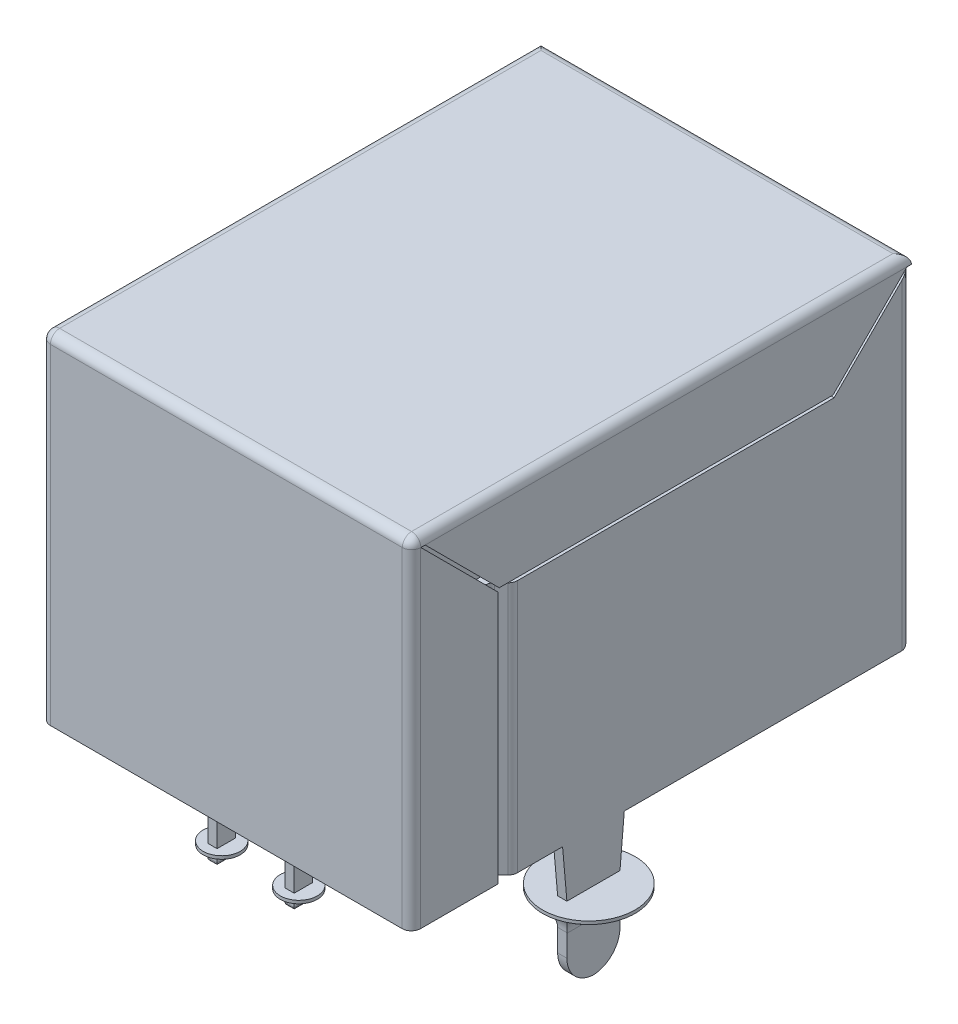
SolidWorks part; units mm, degrees
ref_plane "Plan de face" through (0, 0, 0) normal (0, 0, 1) x (1, 0, 0)
ref_plane "Plan de dessus" through (0, 0, 0) normal (0, 1, 0) x (1, 0, 0)
ref_plane "Plan de droite" through (0, 0, 0) normal (1, 0, 0) x (0, 0, -1)
sketch "Esquisse1" plane through (0, 0, 0) normal (0, 1, 0) x (1, 0, 0)
  line L0 (-0.0121, 2.9364) -> (0.2121, 2.7121)
  line L1 (0.3, 2.5) -> (0.3, 0)
  line L2 (-0.4, 3.0243) -> (-0.4, 15.7879)
  line L3 (-0.4, 15.7879) -> (11.6, 15.7879)
  line L4 (11.6, 15.7879) -> (11.6, 3.0243)
  line L5 (0.3, 0) -> (0, 0)
  line L6 (0, 0) -> (0, 2.3757)
  line L7 (-0.0879, 2.5879) -> (-0.3121, 2.8121)
  line L8 (11.2121, 2.9364) -> (10.9879, 2.7121)
  line L9 (10.9, 2.5) -> (10.9, 0)
  line L10 (11.3, 3.1485) -> (11.3, 15.4879)
  line L11 (11.3, 15.4879) -> (-0.1, 15.4879)
  line L12 (-0.1, 15.4879) -> (-0.1, 3.1485)
  line L13 (10.9, 0) -> (11.2, 0)
  line L14 (11.2, 0) -> (11.2, 2.3757)
  line L15 (11.2879, 2.5879) -> (11.5121, 2.8121)
  arc A0 (11.2, 2.3757) -> (11.2879, 2.5879) centre (11.5, 2.3757) cw
  arc A1 (11.6, 3.0243) -> (11.5121, 2.8121) centre (11.3, 3.0243) cw
  arc A2 (10.9, 2.5) -> (10.9879, 2.7121) centre (11.2, 2.5) cw
  arc A3 (11.2121, 2.9364) -> (11.3, 3.1485) centre (11, 3.1485) ccw
  arc A4 (0, 2.3757) -> (-0.0879, 2.5879) centre (-0.3, 2.3757) ccw
  arc A5 (-0.4, 3.0243) -> (-0.3121, 2.8121) centre (-0.1, 3.0243) ccw
  arc A6 (0.3, 2.5) -> (0.2121, 2.7121) centre (0, 2.5) ccw
  arc A7 (-0.1, 3.1485) -> (-0.0121, 2.9364) centre (0.2, 3.1485) ccw
  point P19 (11.2, 2.5)
  point P26 (11.3, 3.0243)
  point P29 (0, 2.5)
  point P36 (-0.1, 3.0243)
  dimension "D14" = 0.3
  dimension "D1" = 12
  dimension "D2" = 0.3
  dimension "D3" = 0.3
  dimension "D4" = 0.3
  dimension "D5" = 0.3
  dimension "D6" = 0.3
  dimension "D7" = 0.3
  dimension "D8" = 0.3
  dimension "D9" = 13.2
  dimension "D10" = 2.5
  dimension "D11" = 2.5
  dimension "D12" = 135
  dimension "D13" = 135
  dimension "D15" = 0.1
  dimension "D16" = 0.1
extrude "Boss.-Extru.1" add sketch "Esquisse1" along normal blind 8.2
sketch "Esquisse2" plane through (11.6, 0, 0) normal (1, 0, 0) x (0, 0, -1)
  line L0 (15.7879, 8.2) -> (15.7879, 10.7)
  line L1 (15.7879, 10.7) -> (13.2879, 8.2)
  line L2 (3.0243, 8.2) -> (15.7879, 8.2) construction
  line L3 (13.2879, 8.2) -> (15.7879, 8.2)
  dimension "D1" = 2.5
  dimension "D2" = 45
extrude "Boss.-Extru.2" add sketch "Esquisse2" against normal blind 0.3
sketch "Esquisse3" plane through (-0.4, 0, 0) normal (-1, 0, 0) x (0, 0, 1)
  line L0 (-15.7879, 8.2) -> (-15.7879, 10.7)
  line L1 (-15.7879, 10.7) -> (-13.2879, 8.2)
  line L2 (-13.2879, 8.2) -> (-15.7879, 8.2)
extrude "Boss.-Extru.3" add sketch "Esquisse3" against normal blind 0.3
fillet "Congé1" radius 0.3 2 edges at (-0.4, 5.35, -15.7879) (11.6, 5.35, -15.7879)
sketch "Esquisse4" plane through (0, 0, 0) normal (0, -1, 0) x (1, 0, 0)
  line L0 (-0.1, -2.3879) -> (-0.4, -2.3879)
  line L2 (-0.4, -2.3879) -> (-0.4, 0.4121)
  line L3 (-0.4, 0.4121) -> (11.6, 0.4121)
  line L4 (11.6, 0.4121) -> (11.6, -2.3879)
  line L5 (11.6, -2.3879) -> (11.3, -2.3879)
  line L7 (11.3, -2.3879) -> (11.3, 0.1121)
  line L8 (11.3, 0.1121) -> (-0.1, 0.1121)
  line L9 (-0.1, 0.1121) -> (-0.1, -2.3879)
  line L10 (11.3, -15.7879) -> (-0.1, -15.7879) construction
  line L11 (0, -2.3757) -> (0, 0) construction
  line L12 (11.2, 0) -> (11.2, -2.3757) construction
  dimension "D1" = 0.3
  dimension "D2" = 0.3
  dimension "D3" = 0.3
  dimension "D4" = 16.2
  dimension "D5" = 2.8
  dimension "D6" = 2.8
  dimension "D7" = 0.1
  dimension "D8" = 0.1
extrude "Boss.-Extru.6" add sketch "Esquisse4" against normal blind 11
sketch "Esquisse7" plane through (11.6, 0, 0) normal (1, 0, 0) x (0, 0, -1)
  line L0 (2.3879, 8.2) -> (-0.4121, 11)
  line L2 (2.3879, 11) -> (2.3879, 0) construction
  line L4 (2.5879, 8.2) -> (2.3757, 8.2) construction
  line L5 (-0.4121, 11) -> (-0.4121, 0) construction
  line L6 (-0.4121, 11) -> (2.3879, 11)
  line L7 (2.3879, 11) -> (2.3879, 8.2)
  dimension "D1" = 45
extrude "Enlèv. mat.-Extru.5" cut sketch "Esquisse7" against normal through all
fillet "Congé2" radius 0.3 2 edges at (11.6, 5.5, 0.4121) (-0.4, 5.5, 0.4121)
sketch "Esquisse8" plane through (0, 0, 0.4121) normal (0, 0, 1) x (1, 0, 0)
  line L0 (-0.4, 0) -> (-0.4, 10.7) construction
  line L1 (-0.4, 10.7) -> (11.6057, 10.7)
  line L2 (-0.4, 10.7) -> (-0.4, 11)
  line L3 (-0.4, 11) -> (11.6057, 11)
  line L4 (11.6057, 10.7) -> (11.6057, 11)
  line L5 (11.3, 11) -> (-0.1, 11) construction
  dimension "D1" = 0.3
extrude "Boss.-Extru.8" add sketch "Esquisse8" against normal up to surface (16.2 mm away)
fillet "Congé3" radius 0.3 1 edges at (5.6029, 11, 0.4121)
sketch "Esquisse11" plane through (11.6057, 0, 0) normal (1, 0, 0) x (0, 0, -1)
  line L0 (0.0293, 10.7) -> (2.4293, 8.3)
  line L1 (15.7879, 10.7) -> (-0.4121, 10.7) construction
  line L2 (2.4293, 8.3) -> (13.2464, 8.3)
  line L3 (13.2464, 8.3) -> (15.6464, 10.7)
  line L4 (15.6464, 10.7) -> (0.0293, 10.7)
  line L5 (-0.1121, 10.7) -> (2.3879, 8.2) construction
  line L6 (15.4879, 10.4) -> (13.2879, 8.2) construction
  line L7 (3.0243, 8.2) -> (13.2879, 8.2) construction
  dimension "D1" = 0.1
  dimension "D2" = 0.1
  dimension "D3" = 0.1
extrude "Boss.-Extru.10" add sketch "Esquisse11" against normal blind 0.3
sketch "Esquisse12" plane through (-0.4, 0, 0) normal (-1, 0, 0) x (0, 0, 1)
  line L0 (-15.6464, 10.7) -> (-13.2464, 8.3)
  line L1 (-13.2464, 8.3) -> (-2.4293, 8.3)
  line L2 (-2.4293, 8.3) -> (-0.0293, 10.7)
  line L3 (-0.0293, 10.7) -> (-15.6464, 10.7)
extrude "Boss.-Extru.11" add sketch "Esquisse12" against normal blind 0.3
sketch "Esquisse13" plane through (0, 8.2, 0) normal (0, 1, 0) x (1, 0, 0)
  line L1 (-0.1, 15.4879) -> (11.3, 15.4879)
  line L2 (-0.1, 15.4879) -> (-0.1, 15.7879)
  line L3 (-0.1, 15.7879) -> (11.3, 15.7879)
  line L4 (11.3, 15.4879) -> (11.3, 15.7879)
extrude "Boss.-Extru.12" add sketch "Esquisse13" along normal up to next
fillet "Congé4" radius 0.3 5 edges at (-0.4, 10.9121, 0.3243) (11.6057, 10.9121, 0.3243) (5.6029, 11, -15.7879) (-0.4, 11, -7.8379) (11.6057, 11, -7.8379)
sketch "Esquisse14" plane through (0, 0, -15.7879) normal (0, 0, -1) x (-1, 0, 0)
  line L0 (-1.1, 1.5) -> (-10.1, 1.5)
  line L1 (-10.4, 1.8) -> (-10.4, 3.3)
  line L2 (-10.4, 3.7) -> (-10.4, 6.9)
  line L3 (-10.4, 7.3) -> (-10.4, 8.1757)
  line L4 (-10.3121, 8.3879) -> (-8.6879, 10.0121)
  line L5 (-8.4757, 10.1) -> (-2.7243, 10.1)
  line L6 (-2.5121, 10.0121) -> (-0.8879, 8.3879)
  line L7 (-0.8, 8.1757) -> (-0.8, 7.3)
  line L8 (-0.8, 6.9) -> (-0.8, 3.7)
  line L9 (-0.8, 3.3) -> (-0.8, 1.8)
  line L10 (-11.3057, 11) -> (0.1, 11) construction
  line L11 (-11.6, 0) -> (-11.6, 10.4) construction
  line L12 (0.4, 10.4) -> (0.4, 0) construction
  arc A0 (-10.4, 7.3) -> (-10.4, 6.9) centre (-10.4, 7.1) ccw
  arc A1 (-10.4, 3.7) -> (-10.4, 3.3) centre (-10.4, 3.5) ccw
  arc A2 (-0.8, 7.3) -> (-0.8, 6.9) centre (-0.8, 7.1) cw
  arc A3 (-0.8, 3.7) -> (-0.8, 3.3) centre (-0.8, 3.5) cw
  arc A4 (-2.7243, 10.1) -> (-2.5121, 10.0121) centre (-2.7243, 9.8) cw
  arc A5 (-0.8879, 8.3879) -> (-0.8, 8.1757) centre (-1.1, 8.1757) cw
  arc A6 (-0.8, 1.8) -> (-1.1, 1.5) centre (-1.1, 1.8) cw
  arc A7 (-10.1, 1.5) -> (-10.4, 1.8) centre (-10.1, 1.8) cw
  arc A8 (-10.4, 8.1757) -> (-10.3121, 8.3879) centre (-10.1, 8.1757) cw
  arc A9 (-8.6879, 10.0121) -> (-8.4757, 10.1) centre (-8.4757, 9.8) cw
  point P28 (-0.8, 8.3)
  point P35 (-10.4, 8.3)
  dimension "D7" = 0.2
  dimension "D10" = 0.3
  dimension "D1" = 1.2
  dimension "D2" = 8.6
  dimension "D3" = 0.9
  dimension "D4" = 135
  dimension "D5" = 1.2
  dimension "D6" = 1.8
  dimension "D8" = 2
  dimension "D9" = 3.6
extrude "Enlèv. mat.-Extru.6" cut sketch "Esquisse14" against normal up to next
sketch "Esquisse15" plane through (10.4, 0, 0) normal (-1, 0, 0) x (0, 0, 1)
  line L1 (-15.7879, 6.9) -> (-15.4879, 6.9)
  line L2 (-15.7879, 6.9) -> (-15.7879, 3.7)
  line L3 (-15.7879, 3.7) -> (-15.4879, 3.7)
  line L4 (-15.4879, 6.9) -> (-15.4879, 3.7)
extrude "Boss.-Extru.13" add sketch "Esquisse15" along normal blind 0.3
sketch "Esquisse16" plane through (0.8, 0, 0) normal (1, 0, 0) x (0, 0, -1)
  line L1 (15.4879, 6.9) -> (15.7879, 6.9)
  line L2 (15.4879, 6.9) -> (15.4879, 3.7)
  line L3 (15.4879, 3.7) -> (15.7879, 3.7)
  line L4 (15.7879, 6.9) -> (15.7879, 3.7)
extrude "Boss.-Extru.14" add sketch "Esquisse16" along normal blind 0.3
sketch "Esquisse17" plane through (0, 6.9, 0) normal (0, 1, 0) x (1, 0, 0)
  line L0 (0.8, 15.7879) -> (1.1, 15.7879)
  line L3 (1.1, 15.7879) -> (1.3963, 12.4008)
  line L4 (1.3963, 12.4008) -> (1.0963, 12.4008)
  line L5 (1.0963, 12.4008) -> (0.8, 15.7879)
  line L6 (11.3057, 15.4879) -> (-0.1, 15.4879) construction
  line L7 (10.1, 15.7879) -> (10.4, 15.7879)
  line L8 (10.4, 15.7879) -> (10.1037, 12.4008)
  line L9 (10.1037, 12.4008) -> (9.8037, 12.4008)
  line L10 (9.8037, 12.4008) -> (10.1, 15.7879)
  dimension "D1" = 3.4
  dimension "D2" = 95
  dimension "D3" = 95
extrude "Boss.-Extru.15" add sketch "Esquisse17" against normal blind 3.2
fillet "Congé5" radius 0.3 2 edges at (1.1, 5.3, -15.7879) (10.1, 5.3, -15.7879)
sketch "Esquisse18" plane through (0, 0, -15.4879) normal (0, 0, 1) x (1, 0, 0)
  line L0 (11.6, 10.7) -> (11.6, 0) construction
  line L1 (-0.4, 0) -> (11.6, 0)
  line L2 (-0.4, 0) -> (-0.4, 0.3)
  line L3 (-0.4, 0.3) -> (11.6, 0.3)
  line L4 (11.6, 0) -> (11.6, 0.3)
  dimension "D1" = 0.3
extrude "Boss.-Extru.16" add sketch "Esquisse18" along normal blind 2.1
fillet "Congé6" radius 0.3 1 edges at (5.6, 0, -15.7879)
sketch "Esquisse19" plane through (11.3, 0, 0) normal (-1, 0, 0) x (0, 0, 1)
  line L0 (-15.4879, 0) -> (-3.0243, 0) construction
  line L1 (-13.2879, 0) -> (-6.8879, 0)
  line L2 (-13.2879, 0) -> (-13.2879, 0.3)
  line L3 (-13.2879, 0.3) -> (-6.8879, 0.3)
  line L4 (-6.8879, 0) -> (-6.8879, 0.3)
  line L5 (-15.4879, 0.3) -> (-13.3879, 0.3) construction
  line L6 (-13.3879, 0.3) -> (-13.3879, 0) construction
  dimension "D1" = 6.4
  dimension "D2" = 0.1
extrude "Boss.-Extru.17" add sketch "Esquisse19" along normal blind 1.1
sketch "Esquisse20" plane through (-0.1, 0, 0) normal (1, 0, 0) x (0, 0, -1)
  line L1 (6.8879, 0.3) -> (13.2879, 0.3)
  line L2 (6.8879, 0.3) -> (6.8879, 0)
  line L3 (6.8879, 0) -> (13.2879, 0)
  line L4 (13.2879, 0.3) -> (13.2879, 0)
extrude "Boss.-Extru.18" add sketch "Esquisse20" along normal blind 1.1
sketch "Esquisse21" plane through (-0.4, 0, 0) normal (-1, 0, 0) x (0, 0, 1)
  line L0 (-4.4879, 0) -> (-4.6278, -1.6)
  line L1 (-15.4879, 0) -> (-3.0243, 0) construction
  line L2 (-4.6278, -1.6) -> (-6.3479, -1.6)
  line L3 (-6.3479, -1.6) -> (-6.4879, 0)
  line L4 (-6.4879, 0) -> (-4.4879, 0)
  line L5 (-15.7879, 10.7) -> (-15.7879, 0.3) construction
  dimension "D1" = 85
  dimension "D2" = 85
  dimension "D3" = 2
  dimension "D4" = 1.6
  dimension "D5" = 9.3
extrude "Boss.-Extru.19" add sketch "Esquisse21" against normal blind 0.3
sketch "Esquisse22" plane through (11.6, 0, 0) normal (1, 0, 0) x (0, 0, -1)
  line L0 (4.4879, 0) -> (4.6278, -1.6)
  line L1 (4.6278, -1.6) -> (6.3479, -1.6)
  line L2 (6.3479, -1.6) -> (6.4879, 0)
  line L3 (6.4879, 0) -> (4.4879, 0)
extrude "Boss.-Extru.20" add sketch "Esquisse22" against normal blind 0.3
sketch "Esquisse23" plane through (0, 0, -15.4879) normal (0, 0, 1) x (1, 0, 0)
  line L0 (11.3, 10.7) -> (11.3, 0.3)
  line L1 (11.3, 0.3) -> (-0.1, 0.3)
  line L2 (-0.1, 0.3) -> (-0.1, 10.7)
  line L3 (-0.1, 10.7) -> (11.3, 10.7)
  line L4 (8.4393, 9.4121) -> (9.7121, 8.1393)
  line L5 (9.8, 7.9272) -> (9.8, 7.3)
  line L6 (9.8, 7.3) -> (10.4, 7.3)
  line L7 (10.4, 7.3) -> (10.4, 3.3)
  line L8 (10.4, 3.3) -> (9.8, 3.3)
  line L9 (9.8, 3.3) -> (9.8, 2.4)
  line L10 (9.5, 2.1) -> (1.7, 2.1)
  line L11 (1.4, 2.4) -> (1.4, 3.3)
  line L12 (1.4, 3.3) -> (0.8, 3.3)
  line L13 (0.8, 3.3) -> (0.8, 7.3)
  line L14 (0.8, 7.3) -> (1.4, 7.3)
  line L15 (1.4, 7.3) -> (1.4, 7.9272)
  line L16 (1.4879, 8.1393) -> (2.7607, 9.4121)
  line L17 (2.9728, 9.5) -> (8.2272, 9.5)
  line L18 (2.7243, 10.1) -> (8.4757, 10.1) construction
  line L19 (10.1, 1.5) -> (1.1, 1.5) construction
  line L20 (10.4, 8.1757) -> (10.4, 7.3) construction
  line L21 (0.8, 7.3) -> (0.8, 8.1757) construction
  line L22 (8.6879, 10.0121) -> (10.3121, 8.3879) construction
  line L23 (0.8879, 8.3879) -> (2.5121, 10.0121) construction
  arc A0 (1.4, 2.4) -> (1.7, 2.1) centre (1.7, 2.4) ccw
  arc A1 (9.5, 2.1) -> (9.8, 2.4) centre (9.5, 2.4) ccw
  arc A2 (1.4, 7.9272) -> (1.4879, 8.1393) centre (1.7, 7.9272) cw
  arc A3 (2.7607, 9.4121) -> (2.9728, 9.5) centre (2.9728, 9.2) cw
  arc A4 (8.2272, 9.5) -> (8.4393, 9.4121) centre (8.2272, 9.2) cw
  arc A5 (9.7121, 8.1393) -> (9.8, 7.9272) centre (9.5, 7.9272) cw
  dimension "D7" = 0.3
  dimension "D1" = 0.6
  dimension "D2" = 0.6
  dimension "D3" = 0.6
  dimension "D4" = 0.6
  dimension "D5" = 0.6
  dimension "D6" = 0.6
extrude "Boss.-Extru.21" add sketch "Esquisse23" along normal blind 8.4
chamfer "Chanfrein1" distance 0.3 angle 45 19 edges at (9.8, 2.85, -7.0879) (9.7121, 2.1879, -7.0879) (1.4, 2.85, -7.0879) (5.6, 2.1, -7.0879) (1.4879, 2.1879, -7.0879) (1.4, 2.85, -15.4879) (1.4879, 2.1879, -15.4879) (9.8, 2.85, -15.4879) (9.7121, 2.1879, -15.4879) (5.6, 2.1, -15.4879) (1.4, 7.6136, -15.4879) (1.4228, 8.042, -15.4879) (2.1243, 8.7757, -15.4879) (2.858, 9.4772, -15.4879) (5.6, 9.5, -15.4879) (8.342, 9.4772, -15.4879) (9.0757, 8.7757, -15.4879) (9.7772, 8.042, -15.4879) (9.8, 7.6136, -15.4879)
sketch "Esquisse24" plane through (0, 10.7, 0) normal (0, -1, 0) x (1, 0, 0)
  line L0 (-0.1, -7.0879) -> (-0.1, -3.1485)
  line L1 (-0.1, -3.1485) -> (0.3, -3.1485)
  line L2 (0.3, -3.1485) -> (0.3, 0.1121)
  line L3 (-0.1, 0.1121) -> (11.3, 0.1121) construction
  line L4 (0.3, 0.1121) -> (10.9, 0.1121)
  line L5 (10.9, 0.1121) -> (10.9, -3.1485)
  line L6 (10.9, -3.1485) -> (11.3, -3.1485)
  line L7 (11.3, -3.1485) -> (11.3, -7.0879)
  line L8 (11.3, -7.0879) -> (-0.1, -7.0879)
extrude "Boss.-Extru.22" add sketch "Esquisse24" along normal up to surface (10.4 mm away)
sketch "Esquisse25" plane through (0, 0, -7.0879) normal (0, 0, -1) x (-1, 0, 0)
  line L0 (-9.5, 2.1) -> (-1.7, 2.1) construction
  line L1 (-8.4, 7.6) -> (-2.8, 7.6)
  line L2 (-8.4, 7.6) -> (-8.4, 4.4)
  line L3 (-8.4, 4.4) -> (-2.8, 4.4)
  line L4 (-2.8, 7.6) -> (-2.8, 4.4)
  point P6 (-5.6, 2.1)
  point P7 (-5.6, 4.4)
  dimension "D1" = 5.6
  dimension "D2" = 3.2
  dimension "D3" = 2.3
extrude "Boss.-Extru.23" add sketch "Esquisse25" along normal blind 8
chamfer "Chanfrein2" distance 0.3 angle 45 4 edges at (2.8, 6, -15.0879) (5.6, 4.4, -15.0879) (8.4, 6, -15.0879) (5.6, 7.6, -15.0879)
sketch "Esquisse26" plane through (0, 0.3, 0) normal (0, -1, 0) x (1, 0, 0)
  line L1 (4.1556, -3.0336) -> (4.4556, -3.0336)
  line L2 (4.1556, -3.0336) -> (4.1556, -2.4336)
  line L3 (4.1556, -2.4336) -> (4.4556, -2.4336)
  line L4 (4.4556, -3.0336) -> (4.4556, -2.4336)
  line L5 (4.1556, -1.0336) -> (4.4556, -1.0336)
  line L6 (4.1556, -1.0336) -> (4.1556, -0.4336)
  line L7 (4.1556, -0.4336) -> (4.4556, -0.4336)
  line L8 (4.4556, -1.0336) -> (4.4556, -0.4336)
  line L9 (6.6556, -3.0336) -> (6.9556, -3.0336)
  line L10 (6.6556, -3.0336) -> (6.6556, -2.4336)
  line L11 (6.6556, -2.4336) -> (6.9556, -2.4336)
  line L12 (6.9556, -3.0336) -> (6.9556, -2.4336)
  line L13 (6.6556, -1.0336) -> (6.9556, -1.0336)
  line L14 (6.6556, -1.0336) -> (6.6556, -0.4336)
  line L15 (6.6556, -0.4336) -> (6.9556, -0.4336)
  line L16 (6.9556, -1.0336) -> (6.9556, -0.4336)
  dimension "D3" = 1.4
  dimension "D1" = 0.6
  dimension "D2" = 0.3
  dimension "D4" = 2.2
extrude "Boss.-Extru.24" add sketch "Esquisse26" along normal blind 1.9
sketch "Esquisse27" plane through (0, 7.6, 0) normal (0, 1, 0) x (1, 0, 0)
  line L0 (8.2272, 7.0879) -> (2.9728, 7.0879) construction
  line L1 (3.8, 14.1879) -> (5, 14.1879)
  line L2 (3.8, 14.1879) -> (3.8, 7.0879)
  line L3 (3.8, 7.0879) -> (5, 7.0879)
  line L4 (5, 14.1879) -> (5, 7.0879)
  line L5 (2.8, 14.7879) -> (2.8, 7.0879) construction
  line L6 (6.2, 14.1879) -> (7.4, 14.1879)
  line L7 (6.2, 14.1879) -> (6.2, 7.0879)
  line L8 (6.2, 7.0879) -> (7.4, 7.0879)
  line L9 (7.4, 14.1879) -> (7.4, 7.0879)
  line L10 (8.4, 14.7879) -> (8.4, 7.0879) construction
  line L11 (8.4, 14.7879) -> (2.8, 14.7879) construction
  dimension "D1" = 1.2
  dimension "D2" = 1.2
  dimension "D3" = 1
  dimension "D4" = 1
  dimension "D5" = 0.6
extrude "Enlèv. mat.-Extru.7" cut sketch "Esquisse27" against normal blind 0.75
sketch "Esquisse28" plane through (0, 4.4, 0) normal (0, -1, 0) x (1, 0, 0)
  line L1 (3.8, -7.0879) -> (5, -7.0879)
  line L2 (3.8, -7.0879) -> (3.8, -14.1879)
  line L3 (3.8, -14.1879) -> (5, -14.1879)
  line L4 (5, -7.0879) -> (5, -14.1879)
  line L5 (6.2, -7.0879) -> (7.4, -7.0879)
  line L6 (6.2, -7.0879) -> (6.2, -14.1879)
  line L7 (6.2, -14.1879) -> (7.4, -14.1879)
  line L8 (7.4, -7.0879) -> (7.4, -14.1879)
extrude "Enlèv. mat.-Extru.8" cut sketch "Esquisse28" against normal blind 0.75
sketch "Esquisse29" plane through (7.4, 0, 0) normal (-1, 0, 0) x (0, 0, 1)
  line L0 (-14.1879, 6.85) -> (-14.1879, 7.15)
  line L1 (-14.1879, 6.85) -> (-14.1879, 7.6) construction
  line L2 (-14.1879, 7.15) -> (-13.9634, 7.15)
  line L3 (-14.1879, 6.85) -> (-13.8306, 6.85)
  line L4 (-14.1879, 6.85) -> (-7.0879, 6.85) construction
  line L5 (-10.0451, 6.85) -> (-7.0879, 6.85)
  line L6 (-7.0879, 6.85) -> (-7.0879, 7.15)
  line L7 (-7.0879, 7.3) -> (-7.0879, 3.3) construction
  line L8 (-7.0879, 7.15) -> (-9.9124, 7.15)
  line L9 (-7.0879, 5.15) -> (-10.0451, 5.15)
  line L10 (-7.0879, 5.15) -> (-14.1879, 5.15) construction
  line L11 (-7.0879, 5.15) -> (-7.0879, 4.85)
  line L12 (-7.0879, 4.85) -> (-9.9124, 4.85)
  line L13 (-13.8306, 5.15) -> (-14.1879, 5.15)
  line L15 (-14.1879, 5.15) -> (-14.1879, 4.85)
  line L17 (-14.1879, 5.15) -> (-14.1879, 4.4) construction
  line L18 (-14.1879, 4.85) -> (-13.9634, 4.85)
  arc A0 (-13.6035, 6.954) -> (-10.2722, 6.954) centre (-11.9379, 5.5168) cw
  arc A1 (-13.7463, 7.2429) -> (-10.1294, 7.2429) centre (-11.9379, 5.5168) cw
  arc A2 (-13.6035, 5.046) -> (-10.2722, 5.046) centre (-11.9379, 6.4832) ccw
  arc A3 (-13.7463, 4.7571) -> (-10.1294, 4.7571) centre (-11.9379, 6.4832) ccw
  arc A4 (-13.7463, 4.7571) -> (-13.9634, 4.85) centre (-13.9634, 4.55) ccw
  arc A5 (-13.6035, 5.046) -> (-13.8306, 5.15) centre (-13.8306, 4.85) ccw
  arc A6 (-10.1294, 4.7571) -> (-9.9124, 4.85) centre (-9.9124, 4.55) cw
  arc A7 (-10.2722, 5.046) -> (-10.0451, 5.15) centre (-10.0451, 4.85) cw
  arc A8 (-10.2722, 6.954) -> (-10.0451, 6.85) centre (-10.0451, 7.15) ccw
  arc A9 (-9.9124, 7.15) -> (-10.1294, 7.2429) centre (-9.9124, 7.45) cw
  arc A10 (-13.6035, 6.954) -> (-13.8306, 6.85) centre (-13.8306, 7.15) cw
  arc A11 (-13.7463, 7.2429) -> (-13.9634, 7.15) centre (-13.9634, 7.45) cw
  point P35 (-13.8306, 4.85)
  point P38 (-13.6879, 5.15)
  point P41 (-10.0451, 4.85)
  point P44 (-10.1879, 5.15)
  point P47 (-10.1879, 6.85)
  point P50 (-10.0451, 7.15)
  point P53 (-13.6879, 6.85)
  point P56 (-13.8306, 7.15)
  dimension "D4" = 0.3
  dimension "D5" = 2.2
  dimension "D7" = 2.2
  dimension "D8" = 0.3
  dimension "D1" = 0.3
  dimension "D2" = 0.5
  dimension "D3" = 3.5
  dimension "D6" = 0.3
extrude "Boss.-Extru.32" add sketch "Esquisse29" along normal blind 1.2
pattern_linear "Répétition linéaire1" count 2 spacing 2.4 along (-1, 0, 0) of "Boss.-Extru.32"
sketch "Esquisse30" plane through (0, -1.6, 0) normal (0, -1, 0) x (1, 0, 0)
  line L0 (-0.4, -6.3479) -> (-0.4, -4.6278) construction
  line L1 (-0.1, -4.6278) -> (-0.4, -4.6278) construction
  line L2 (11.3, -4.6278) -> (11.6, -4.6278) construction
  line L3 (4.4556, -0.4336) -> (4.1556, -0.4336) construction
  line L4 (4.1556, -0.4336) -> (4.1556, -1.0336) construction
  line L5 (4.1556, -2.4336) -> (4.1556, -3.0336) construction
  line L6 (6.9556, -0.4336) -> (6.6556, -0.4336) construction
  circle A0 centre (-0.25, -5.4879) radius 1.5
  circle A1 centre (11.45, -5.4879) radius 1.5
  circle A2 centre (4.3056, -0.7336) radius 0.6
  circle A3 centre (6.8056, -0.7336) radius 0.6
  circle A4 centre (4.3056, -2.7336) radius 0.6
  circle A5 centre (6.8056, -2.7336) radius 0.6
  point P4 (-0.4, -5.4879)
  point P9 (-0.25, -4.6278)
  point P12 (11.45, -4.6278)
  point P23 (4.3056, -0.4336)
  point P26 (4.1556, -0.7336)
  point P29 (4.1556, -2.7336)
  point P32 (6.8056, -0.4336)
  dimension "D1" = 3
  dimension "D2" = 1.2
extrude "Boss.-Extru.33" add sketch "Esquisse30" along normal blind 0.1
sketch "Esquisse31" plane through (0, -1.7, 0) normal (0, -1, 0) x (1, 0, 0)
  line L1 (-0.4, -4.6278) -> (-0.1, -4.6278)
  line L2 (-0.4, -4.6278) -> (-0.4, -6.3479)
  line L3 (-0.4, -6.3479) -> (-0.1, -6.3479)
  line L4 (-0.1, -4.6278) -> (-0.1, -6.3479)
  line L5 (11.3, -4.6278) -> (11.6, -4.6278)
  line L6 (11.3, -4.6278) -> (11.3, -6.3479)
  line L7 (11.3, -6.3479) -> (11.6, -6.3479)
  line L8 (11.6, -4.6278) -> (11.6, -6.3479)
extrude "Boss.-Extru.34" add sketch "Esquisse31" along normal blind 2.4
sketch "Esquisse32" plane through (0, -1.7, 0) normal (0, -1, 0) x (1, 0, 0)
  line L1 (4.1556, -0.4336) -> (4.4556, -0.4336)
  line L2 (4.1556, -0.4336) -> (4.1556, -1.0336)
  line L3 (4.1556, -1.0336) -> (4.4556, -1.0336)
  line L4 (4.4556, -0.4336) -> (4.4556, -1.0336)
  line L5 (6.6556, -0.4336) -> (6.9556, -0.4336)
  line L6 (6.6556, -0.4336) -> (6.6556, -1.0336)
  line L7 (6.6556, -1.0336) -> (6.9556, -1.0336)
  line L8 (6.9556, -0.4336) -> (6.9556, -1.0336)
  line L9 (4.1556, -2.4336) -> (4.4556, -2.4336)
  line L10 (4.1556, -2.4336) -> (4.1556, -3.0336)
  line L11 (4.1556, -3.0336) -> (4.4556, -3.0336)
  line L12 (4.4556, -2.4336) -> (4.4556, -3.0336)
  line L13 (6.6556, -2.4336) -> (6.9556, -2.4336)
  line L14 (6.6556, -2.4336) -> (6.6556, -3.0336)
  line L15 (6.6556, -3.0336) -> (6.9556, -3.0336)
  line L16 (6.9556, -2.4336) -> (6.9556, -3.0336)
extrude "Boss.-Extru.35" add sketch "Esquisse32" along normal blind 1.4
fillet "Congé8" radius 0.8 8 edges at (11.6, -1.7, -5.4879) (11.45, -1.7, -6.3479) (11.3, -1.7, -5.4879) (11.45, -1.7, -4.6278) (-0.25, -1.7, -4.6278) (-0.1, -1.7, -5.4879) (-0.25, -1.7, -6.3479) (-0.4, -1.7, -5.4879)
fillet "Congé9" radius 0.9 4 edges at (11.45, -4.1, -4.6278) (11.45, -4.1, -6.3479) (-0.25, -4.1, -4.6278) (-0.25, -4.1, -6.3479)
fillet "Congé10" radius 0.2 16 edges at (6.6556, -1.7, -0.7336) (6.8056, -1.7, -1.0336) (6.8056, -1.7, -0.4336) (6.9556, -1.7, -0.7336) (4.1556, -1.7, -0.7336) (4.3056, -1.7, -1.0336) (4.1556, -1.7, -2.7336) (4.3056, -1.7, -3.0336) (6.6556, -1.7, -2.7336) (6.8056, -1.7, -3.0336) (4.3056, -1.7, -0.4336) (4.4556, -1.7, -0.7336) (4.3056, -1.7, -2.4336) (4.4556, -1.7, -2.7336) (6.8056, -1.7, -2.4336) (6.9556, -1.7, -2.7336)
sketch "Esquisse33" plane through (6.9556, 0, 0) normal (1, 0, 0) x (0, 0, -1)
  line L0 (3.0336, -3.1) -> (3.0336, -1.9) construction
  line L1 (0.4336, -3.1) -> (3.0336, -3.1)
  line L2 (0.4336, -3.1) -> (0.4336, -2.1)
  line L3 (0.4336, -2.1) -> (3.0336, -2.1)
  line L4 (3.0336, -3.1) -> (3.0336, -2.1)
  dimension "D1" = 1
extrude "Enlèv. mat.-Extru.9" cut sketch "Esquisse33" against normal through all
fillet "Congé11" radius 0.1 16 edges at (4.3056, -2.1, -2.4336) (4.1556, -2.1, -2.7336) (4.3056, -2.1, -3.0336) (4.4556, -2.1, -2.7336) (6.6556, -2.1, -2.7336) (6.8056, -2.1, -3.0336) (6.9556, -2.1, -2.7336) (6.8056, -2.1, -2.4336) (6.8056, -2.1, -0.4336) (6.9556, -2.1, -0.7336) (6.8056, -2.1, -1.0336) (6.6556, -2.1, -0.7336) (4.3056, -2.1, -0.4336) (4.4556, -2.1, -0.7336) (4.3056, -2.1, -1.0336) (4.1556, -2.1, -0.7336)
